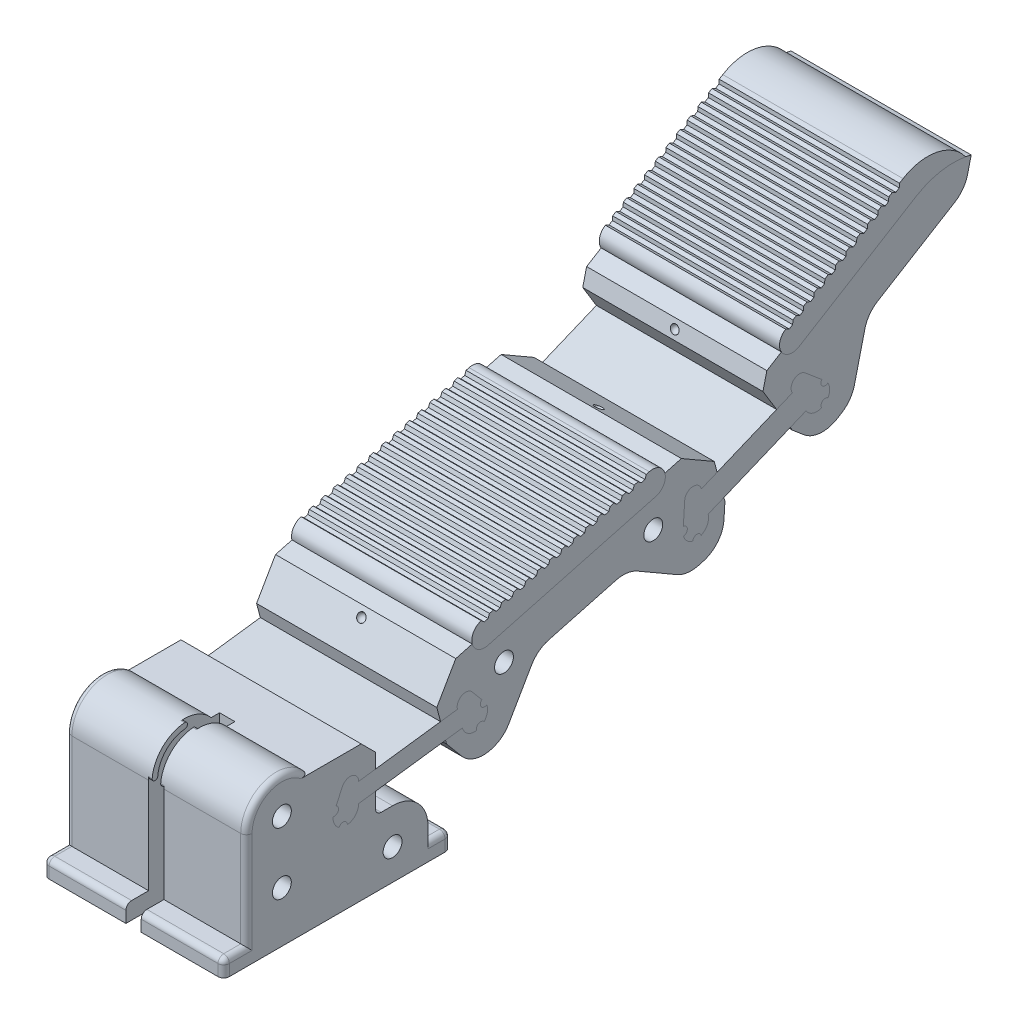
SolidWorks part; units mm, degrees
other "<finger_flexure_print>-<Pulley Cover Fillet>"
ref_plane "Front Plane" through (0, 0, 0) normal (0, 0, 1) x (1, 0, 0)
ref_plane "Top Plane" through (0, 0, 0) normal (0, 1, 0) x (1, 0, 0)
ref_plane "Right Plane" through (0, 0, 0) normal (1, 0, 0) x (0, 0, -1)
inserted part "finger_flexure_print"
sketch "Sketch1" plane through (15.875, 0, 0) normal (1, 0, 0) x (0, 0, -1)
  line L4 (69.9743, 11.2938) -> (87.2122, 18.4339)
  line L5 (65.8378, 15.4405) -> (65.6013, 11.5982)
  line L6 (84.8057, 22.3731) -> (68.7839, 15.7366)
  line L7 (90.0086, 21.8108) -> (87.0523, 24.3021)
  line L8 (69.9743, 11.2938) -> (87.2122, 18.4339)
  line L9 (65.8378, 15.4405) -> (65.6013, 11.5982)
  line L10 (84.8057, 22.3731) -> (68.7839, 15.7366)
  line L11 (90.0086, 21.8108) -> (87.0523, 24.3021)
  line L12 (30.1016, 2.9234) -> (28.4068, 4.9462)
  line L13 (8.4007, -2.0861) -> (26.6852, 0.3211)
  line L14 (5.5407, 1.9358) -> (4.4272, -0.4567)
  line L15 (25.8081, 3.5947) -> (8.4007, 1.3029)
  line L16 (30.1016, 2.9234) -> (28.4068, 4.9462)
  line L17 (8.4007, -2.0861) -> (26.6852, 0.3211)
  line L18 (5.5407, 1.9358) -> (4.4272, -0.4567)
  line L19 (25.8081, 3.5947) -> (8.4007, 1.3029)
  line L45 (85.9658, 28.8324) -> (106.651, 41.4695)
  line L46 (84.2607, 32.3908) -> (83.6198, 32.6725)
  line L47 (84.858, 32.7557) -> (84.2607, 32.3908)
  line L48 (84.8999, 33.4545) -> (84.858, 32.7557)
  line L49 (85.4972, 33.8194) -> (84.8999, 33.4545)
  line L50 (86.138, 33.5377) -> (85.4972, 33.8194)
  line L51 (86.7354, 33.9026) -> (86.138, 33.5377)
  line L52 (86.7772, 34.6014) -> (86.7354, 33.9026)
  line L53 (87.3746, 34.9663) -> (86.7772, 34.6014)
  line L54 (88.0154, 34.6846) -> (87.3746, 34.9663)
  line L55 (88.6128, 35.0496) -> (88.0154, 34.6846)
  line L56 (88.6546, 35.7483) -> (88.6128, 35.0496)
  line L57 (31.1626, 10.6686) -> (60.7665, 18.601)
  line L58 (30.5329, 14.5639) -> (29.9979, 15.0153)
  line L59 (31.2091, 14.7451) -> (30.5329, 14.5639)
  line L60 (31.4468, 15.4035) -> (31.2091, 14.7451)
  line L61 (32.1229, 15.5847) -> (31.4468, 15.4035)
  line L62 (32.658, 15.1333) -> (32.1229, 15.5847)
  line L63 (33.3341, 15.3145) -> (32.658, 15.1333)
  line L64 (33.5718, 15.9729) -> (33.3341, 15.3145)
  line L65 (34.248, 16.1541) -> (33.5718, 15.9729)
  line L66 (34.783, 15.7027) -> (34.248, 16.1541)
  line L67 (35.4592, 15.8839) -> (34.783, 15.7027)
  line L68 (35.6968, 16.5423) -> (35.4592, 15.8839)
  line L69 (36.373, 16.7235) -> (35.6968, 16.5423)
  line L70 (36.908, 16.2721) -> (36.373, 16.7235)
  line L71 (37.5842, 16.4533) -> (36.908, 16.2721)
  line L72 (37.8219, 17.1117) -> (37.5842, 16.4533)
  line L73 (38.498, 17.2929) -> (37.8219, 17.1117)
  line L74 (39.0331, 16.8415) -> (38.498, 17.2929)
  line L75 (39.7092, 17.0227) -> (39.0331, 16.8415)
  line L76 (39.9469, 17.6811) -> (39.7092, 17.0227)
  line L77 (40.6231, 17.8623) -> (39.9469, 17.6811)
  line L78 (41.1581, 17.4109) -> (40.6231, 17.8623)
  line L79 (41.8343, 17.5921) -> (41.1581, 17.4109)
  line L80 (42.072, 18.2505) -> (41.8343, 17.5921)
  line L81 (42.7481, 18.4317) -> (42.072, 18.2505)
  line L82 (43.2832, 17.9803) -> (42.7481, 18.4317)
  line L83 (43.9593, 18.1615) -> (43.2832, 17.9803)
  line L84 (44.197, 18.8199) -> (43.9593, 18.1615)
  line L85 (44.8731, 19.0011) -> (44.197, 18.8199)
  line L86 (45.4082, 18.5497) -> (44.8731, 19.0011)
  line L87 (46.0843, 18.7309) -> (45.4082, 18.5497)
  line L88 (46.322, 19.3893) -> (46.0843, 18.7309)
  line L89 (46.9982, 19.5705) -> (46.322, 19.3893)
  line L90 (47.5332, 19.1191) -> (46.9982, 19.5705)
  line L91 (48.2094, 19.3003) -> (47.5332, 19.1191)
  line L92 (48.4471, 19.9587) -> (48.2094, 19.3003)
  line L93 (49.1232, 20.1399) -> (48.4471, 19.9587)
  line L94 (49.6583, 19.6885) -> (49.1232, 20.1399)
  line L95 (50.3344, 19.8697) -> (49.6583, 19.6885)
  line L96 (50.5721, 20.5281) -> (50.3344, 19.8697)
  line L97 (51.2482, 20.7093) -> (50.5721, 20.5281)
  line L98 (51.7833, 20.2579) -> (51.2482, 20.7093)
  line L99 (52.4594, 20.4391) -> (51.7833, 20.2579)
  line L100 (52.6971, 21.0975) -> (52.4594, 20.4391)
  line L101 (53.3733, 21.2787) -> (52.6971, 21.0975)
  line L102 (53.9083, 20.8273) -> (53.3733, 21.2787)
  line L103 (54.5845, 21.0085) -> (53.9083, 20.8273)
  line L104 (54.8222, 21.6669) -> (54.5845, 21.0085)
  line L105 (55.4983, 21.8481) -> (54.8222, 21.6669)
  line L106 (56.0334, 21.3967) -> (55.4983, 21.8481)
  line L107 (56.7095, 21.5779) -> (56.0334, 21.3967)
  line L108 (56.9472, 22.2363) -> (56.7095, 21.5779)
  line L109 (57.6234, 22.4175) -> (56.9472, 22.2363)
  line L110 (58.1584, 21.9661) -> (57.6234, 22.4175)
  line L111 (58.8346, 22.1473) -> (58.1584, 21.9661)
  line L112 (59.0722, 22.8057) -> (58.8346, 22.1473)
  line L113 (59.6018, 22.9476) -> (59.0722, 22.8057)
  line L114 (31.1626, 10.6686) -> (60.7665, 18.601)
  line L115 (30.5329, 14.5639) -> (29.9979, 15.0153)
  line L116 (31.2091, 14.7451) -> (30.5329, 14.5639)
  line L117 (31.4468, 15.4035) -> (31.2091, 14.7451)
  line L118 (32.1229, 15.5847) -> (31.4468, 15.4035)
  line L119 (32.658, 15.1333) -> (32.1229, 15.5847)
  line L120 (33.3341, 15.3145) -> (32.658, 15.1333)
  line L121 (33.5718, 15.9729) -> (33.3341, 15.3145)
  line L122 (34.248, 16.1541) -> (33.5718, 15.9729)
  line L123 (34.783, 15.7027) -> (34.248, 16.1541)
  line L124 (35.4592, 15.8839) -> (34.783, 15.7027)
  line L125 (35.6968, 16.5423) -> (35.4592, 15.8839)
  line L126 (36.373, 16.7235) -> (35.6968, 16.5423)
  line L127 (36.908, 16.2721) -> (36.373, 16.7235)
  line L128 (37.5842, 16.4533) -> (36.908, 16.2721)
  line L129 (37.8219, 17.1117) -> (37.5842, 16.4533)
  line L130 (38.498, 17.2929) -> (37.8219, 17.1117)
  line L131 (39.0331, 16.8415) -> (38.498, 17.2929)
  line L132 (39.7092, 17.0227) -> (39.0331, 16.8415)
  line L133 (39.9469, 17.6811) -> (39.7092, 17.0227)
  line L134 (40.6231, 17.8623) -> (39.9469, 17.6811)
  line L135 (41.1581, 17.4109) -> (40.6231, 17.8623)
  line L136 (41.8343, 17.5921) -> (41.1581, 17.4109)
  line L137 (42.072, 18.2505) -> (41.8343, 17.5921)
  line L138 (42.7481, 18.4317) -> (42.072, 18.2505)
  line L139 (43.2832, 17.9803) -> (42.7481, 18.4317)
  line L140 (43.9593, 18.1615) -> (43.2832, 17.9803)
  line L141 (44.197, 18.8199) -> (43.9593, 18.1615)
  line L142 (44.8731, 19.0011) -> (44.197, 18.8199)
  line L143 (45.4082, 18.5497) -> (44.8731, 19.0011)
  line L144 (46.0843, 18.7309) -> (45.4082, 18.5497)
  line L145 (46.322, 19.3893) -> (46.0843, 18.7309)
  line L146 (46.9982, 19.5705) -> (46.322, 19.3893)
  line L147 (47.5332, 19.1191) -> (46.9982, 19.5705)
  line L148 (48.2094, 19.3003) -> (47.5332, 19.1191)
  line L149 (48.4471, 19.9587) -> (48.2094, 19.3003)
  line L150 (49.1232, 20.1399) -> (48.4471, 19.9587)
  line L151 (49.6583, 19.6885) -> (49.1232, 20.1399)
  line L152 (50.3344, 19.8697) -> (49.6583, 19.6885)
  line L153 (50.5721, 20.5281) -> (50.3344, 19.8697)
  line L154 (51.2482, 20.7093) -> (50.5721, 20.5281)
  line L155 (51.7833, 20.2579) -> (51.2482, 20.7093)
  line L156 (52.4594, 20.4391) -> (51.7833, 20.2579)
  line L157 (52.6971, 21.0975) -> (52.4594, 20.4391)
  line L158 (53.3733, 21.2787) -> (52.6971, 21.0975)
  line L159 (53.9083, 20.8273) -> (53.3733, 21.2787)
  line L160 (54.5845, 21.0085) -> (53.9083, 20.8273)
  line L161 (54.8222, 21.6669) -> (54.5845, 21.0085)
  line L162 (55.4983, 21.8481) -> (54.8222, 21.6669)
  line L163 (56.0334, 21.3967) -> (55.4983, 21.8481)
  line L164 (56.7095, 21.5779) -> (56.0334, 21.3967)
  line L165 (56.9472, 22.2363) -> (56.7095, 21.5779)
  line L166 (57.6234, 22.4175) -> (56.9472, 22.2363)
  line L167 (58.1584, 21.9661) -> (57.6234, 22.4175)
  line L168 (58.8346, 22.1473) -> (58.1584, 21.9661)
  line L169 (59.0722, 22.8057) -> (58.8346, 22.1473)
  line L170 (59.6018, 22.9476) -> (59.0722, 22.8057)
  line L171 (89.252, 36.1133) -> (88.6546, 35.7483)
  line L172 (89.8928, 35.8316) -> (89.252, 36.1133)
  line L173 (90.4901, 36.1965) -> (89.8928, 35.8316)
  line L174 (90.532, 36.8953) -> (90.4901, 36.1965)
  line L175 (91.1293, 37.2602) -> (90.532, 36.8953)
  line L176 (91.7702, 36.9785) -> (91.1293, 37.2602)
  line L177 (92.3675, 37.3435) -> (91.7702, 36.9785)
  line L178 (92.4094, 38.0422) -> (92.3675, 37.3435)
  line L179 (93.0067, 38.4071) -> (92.4094, 38.0422)
  line L180 (93.6475, 38.1255) -> (93.0067, 38.4071)
  line L181 (94.2449, 38.4904) -> (93.6475, 38.1255)
  line L182 (94.2867, 39.1891) -> (94.2449, 38.4904)
  line L183 (94.8841, 39.5541) -> (94.2867, 39.1891)
  line L184 (95.5249, 39.2724) -> (94.8841, 39.5541)
  line L185 (96.1222, 39.6373) -> (95.5249, 39.2724)
  line L186 (96.1641, 40.3361) -> (96.1222, 39.6373)
  line L187 (96.7615, 40.701) -> (96.1641, 40.3361)
  line L188 (97.4023, 40.4193) -> (96.7615, 40.701)
  line L189 (97.9996, 40.7843) -> (97.4023, 40.4193)
  line L190 (98.0415, 41.483) -> (97.9996, 40.7843)
  line L191 (98.6388, 41.848) -> (98.0415, 41.483)
  line L192 (99.2796, 41.5663) -> (98.6388, 41.848)
  line L193 (99.877, 41.9312) -> (99.2796, 41.5663)
  line L194 (99.9189, 42.63) -> (99.877, 41.9312)
  line L195 (100.5162, 42.9949) -> (99.9189, 42.63)
  line L196 (101.157, 42.7132) -> (100.5162, 42.9949)
  line L197 (101.7544, 43.0782) -> (101.157, 42.7132)
  line L198 (101.7962, 43.7769) -> (101.7544, 43.0782)
  line L199 (102.3936, 44.1418) -> (101.7962, 43.7769)
  line L200 (103.0344, 43.8602) -> (102.3936, 44.1418)
  line L201 (103.6317, 44.2251) -> (103.0344, 43.8602)
  line L202 (103.6736, 44.9238) -> (103.6317, 44.2251)
  line L203 (104.305, 45.3096) -> (103.6736, 44.9238)
  line L204 (85.9658, 28.8324) -> (106.651, 41.4695)
  line L205 (84.2607, 32.3908) -> (83.6198, 32.6725)
  line L206 (84.858, 32.7557) -> (84.2607, 32.3908)
  line L207 (84.8999, 33.4545) -> (84.858, 32.7557)
  line L208 (85.4972, 33.8194) -> (84.8999, 33.4545)
  line L209 (86.138, 33.5377) -> (85.4972, 33.8194)
  line L210 (86.7354, 33.9026) -> (86.138, 33.5377)
  line L211 (86.7772, 34.6014) -> (86.7354, 33.9026)
  line L212 (87.3746, 34.9663) -> (86.7772, 34.6014)
  line L213 (88.0154, 34.6846) -> (87.3746, 34.9663)
  line L214 (88.6128, 35.0496) -> (88.0154, 34.6846)
  line L215 (88.6546, 35.7483) -> (88.6128, 35.0496)
  line L216 (89.252, 36.1133) -> (88.6546, 35.7483)
  line L217 (89.8928, 35.8316) -> (89.252, 36.1133)
  line L218 (90.4901, 36.1965) -> (89.8928, 35.8316)
  line L219 (90.532, 36.8953) -> (90.4901, 36.1965)
  line L220 (91.1293, 37.2602) -> (90.532, 36.8953)
  line L221 (91.7702, 36.9785) -> (91.1293, 37.2602)
  line L222 (92.3675, 37.3435) -> (91.7702, 36.9785)
  line L223 (92.4094, 38.0422) -> (92.3675, 37.3435)
  line L224 (93.0067, 38.4071) -> (92.4094, 38.0422)
  line L225 (93.6475, 38.1255) -> (93.0067, 38.4071)
  line L226 (94.2449, 38.4904) -> (93.6475, 38.1255)
  line L227 (94.2867, 39.1891) -> (94.2449, 38.4904)
  line L228 (94.8841, 39.5541) -> (94.2867, 39.1891)
  line L229 (95.5249, 39.2724) -> (94.8841, 39.5541)
  line L230 (96.1222, 39.6373) -> (95.5249, 39.2724)
  line L231 (96.1641, 40.3361) -> (96.1222, 39.6373)
  line L232 (96.7615, 40.701) -> (96.1641, 40.3361)
  line L233 (97.4023, 40.4193) -> (96.7615, 40.701)
  line L234 (97.9996, 40.7843) -> (97.4023, 40.4193)
  line L235 (98.0415, 41.483) -> (97.9996, 40.7843)
  line L236 (98.6388, 41.848) -> (98.0415, 41.483)
  line L237 (99.2796, 41.5663) -> (98.6388, 41.848)
  line L238 (99.877, 41.9312) -> (99.2796, 41.5663)
  line L239 (99.9189, 42.63) -> (99.877, 41.9312)
  line L240 (100.5162, 42.9949) -> (99.9189, 42.63)
  line L241 (101.157, 42.7132) -> (100.5162, 42.9949)
  line L242 (101.7544, 43.0782) -> (101.157, 42.7132)
  line L243 (101.7962, 43.7769) -> (101.7544, 43.0782)
  line L244 (102.3936, 44.1418) -> (101.7962, 43.7769)
  line L245 (103.0344, 43.8602) -> (102.3936, 44.1418)
  line L246 (103.6317, 44.2251) -> (103.0344, 43.8602)
  line L247 (103.6736, 44.9238) -> (103.6317, 44.2251)
  line L248 (104.305, 45.3096) -> (103.6736, 44.9238)
  arc A3 (60.7665, 18.601) -> (59.6018, 22.9476) centre (60.1841, 20.7743) ccw
  arc A4 (29.9979, 15.0153) -> (31.1626, 10.6686) centre (30.5802, 12.8419) ccw
  arc A5 (60.7665, 18.601) -> (59.6018, 22.9476) centre (60.1841, 20.7743) ccw
  arc A6 (29.9979, 15.0153) -> (31.1626, 10.6686) centre (30.5802, 12.8419) ccw
  arc A8 (115.3247, 43.1358) -> (106.651, 41.4695) centre (113.2105, 30.7324) ccw
  arc A9 (83.6198, 32.6725) -> (85.9658, 28.8324) centre (84.7928, 30.7524) ccw
  arc A10 (115.3247, 43.1358) -> (104.305, 45.3096) centre (108.632, 38.2267) ccw
  arc A11 (115.3247, 43.1358) -> (106.651, 41.4695) centre (113.2105, 30.7324) ccw
  arc A12 (83.6198, 32.6725) -> (85.9658, 28.8324) centre (84.7928, 30.7524) ccw
  arc A13 (115.3247, 43.1358) -> (104.305, 45.3096) centre (108.632, 38.2267) ccw
  arc A22 (90.0086, 21.8108) -> (91.0671, 20.7553) centre (90.5822, 21.3275) ccw
  arc A23 (91.0776, 18.4765) -> (91.0671, 20.7553) centre (89.1323, 19.6069) ccw
  arc A24 (91.0776, 18.4765) -> (89.9555, 17.513) centre (90.598, 17.8999) ccw
  arc A25 (87.2122, 18.4339) -> (89.9555, 17.513) centre (89.1323, 19.6069) ccw
  arc A26 (68.7493, 8.671) -> (69.9743, 11.2938) centre (67.801, 10.7114) ccw
  arc A27 (68.7493, 8.671) -> (67.2777, 8.5231) centre (68.026, 8.4727) ccw
  arc A28 (65.6346, 10.1039) -> (67.2777, 8.5231) centre (67.801, 10.7114) ccw
  arc A29 (65.6346, 10.1039) -> (65.6013, 11.5982) centre (65.5553, 10.8497) ccw
  arc A30 (68.7839, 15.7366) -> (65.8378, 15.4405) centre (67.335, 15.3484) ccw
  arc A31 (87.0523, 24.3021) -> (84.8057, 22.3731) centre (86.0857, 23.1551) ccw
  arc A32 (90.0086, 21.8108) -> (91.0671, 20.7553) centre (90.5822, 21.3275) ccw
  arc A33 (91.0776, 18.4765) -> (91.0671, 20.7553) centre (89.1323, 19.6069) ccw
  arc A34 (91.0776, 18.4765) -> (89.9555, 17.513) centre (90.598, 17.8999) ccw
  arc A35 (87.2122, 18.4339) -> (89.9555, 17.513) centre (89.1323, 19.6069) ccw
  arc A36 (68.7493, 8.671) -> (69.9743, 11.2938) centre (67.801, 10.7114) ccw
  arc A37 (68.7493, 8.671) -> (67.2777, 8.5231) centre (68.026, 8.4727) ccw
  arc A38 (65.6346, 10.1039) -> (67.2777, 8.5231) centre (67.801, 10.7114) ccw
  arc A39 (65.6346, 10.1039) -> (65.6013, 11.5982) centre (65.5553, 10.8497) ccw
  arc A40 (68.7839, 15.7366) -> (65.8378, 15.4405) centre (67.335, 15.3484) ccw
  arc A41 (87.0523, 24.3021) -> (84.8057, 22.3731) centre (86.0857, 23.1551) ccw
  arc A43 (30.1016, 2.9234) -> (30.9624, 1.7013) centre (30.5832, 2.3485) ccw
  arc A44 (30.4952, -0.6406) -> (30.9624, 1.7013) centre (28.8586, 0.9035) ccw
  arc A45 (30.4952, -0.6406) -> (29.183, -1.323) centre (29.8968, -1.0927) ccw
  arc A46 (26.6852, 0.3211) -> (29.183, -1.323) centre (28.8586, 0.9035) ccw
  arc A47 (6.4135, -4.3207) -> (8.4007, -2.0861) centre (6.1507, -2.0861) ccw
  arc A48 (6.4135, -4.3207) -> (4.9695, -4.0011) centre (5.6645, -4.2829) ccw
  arc A49 (3.9121, -1.8599) -> (4.9695, -4.0011) centre (6.1507, -2.0861) ccw
  arc A50 (3.9121, -1.8599) -> (4.4272, -0.4567) centre (4.1108, -1.1367) ccw
  arc A51 (8.4007, 1.3029) -> (5.5407, 1.9358) centre (6.9007, 1.3029) ccw
  arc A52 (28.4068, 4.9462) -> (25.8081, 3.5947) centre (27.257, 3.9829) ccw
  arc A53 (30.1016, 2.9234) -> (30.9624, 1.7013) centre (30.5832, 2.3485) ccw
  arc A54 (30.4952, -0.6406) -> (30.9624, 1.7013) centre (28.8586, 0.9035) ccw
  arc A55 (30.4952, -0.6406) -> (29.183, -1.323) centre (29.8968, -1.0927) ccw
  arc A56 (26.6852, 0.3211) -> (29.183, -1.323) centre (28.8586, 0.9035) ccw
  arc A57 (6.4135, -4.3207) -> (8.4007, -2.0861) centre (6.1507, -2.0861) ccw
  arc A58 (6.4135, -4.3207) -> (4.9695, -4.0011) centre (5.6645, -4.2829) ccw
  arc A59 (3.9121, -1.8599) -> (4.9695, -4.0011) centre (6.1507, -2.0861) ccw
  arc A60 (3.9121, -1.8599) -> (4.4272, -0.4567) centre (4.1108, -1.1367) ccw
  arc A61 (8.4007, 1.3029) -> (5.5407, 1.9358) centre (6.9007, 1.3029) ccw
  arc A62 (28.4068, 4.9462) -> (25.8081, 3.5947) centre (27.257, 3.9829) ccw
  dimension "D1" = 0
  dimension "D2" = 0
  dimension "D3" = 0
  dimension "D4" = 0
extrude "Pad Material" add sketch "Sketch1" against normal up to surface (31.75 mm away) separate body
sketch "Sketch2" plane through (15.875, 0, 0) normal (1, 0, 0) x (0, 0, -1)
  line L0 (11.375, 2.4005) -> (11.375, 1.6945)
  line L1 (25.8081, 3.5947) -> (8.4007, 1.3029) construction
  line L2 (22.651, 3.8851) -> (11.375, 2.4005) construction
  line L3 (8.4007, -2.0861) -> (26.6852, 0.3211) construction
  line L4 (11.375, -2.4005) -> (23.8936, -0.7524) construction
  line L5 (22.8338, 3.2031) -> (11.375, 1.6945)
  line L6 (22.651, 3.8851) -> (11.375, 2.4005)
  line L7 (11.375, -1.6945) -> (23.7109, -0.0704)
  line L8 (11.375, -2.4005) -> (23.8936, -0.7524)
  line L9 (22.651, 3.8851) -> (22.8338, 3.2031)
  line L10 (71.3728, 17.5667) -> (71.5555, 16.8847)
  line L11 (81.6646, 21.8297) -> (82.034, 21.225)
  line L12 (81.6646, 21.8297) -> (71.3728, 17.5667) construction
  line L13 (84.8057, 22.3731) -> (68.7839, 15.7366) construction
  line L14 (69.9743, 11.2938) -> (87.2122, 18.4339) construction
  line L15 (72.9287, 11.7598) -> (84.81, 16.6812) construction
  line L16 (81.6646, 21.8297) -> (71.3728, 17.5667)
  line L17 (82.034, 21.225) -> (71.5555, 16.8847)
  line L18 (72.746, 12.4418) -> (84.4406, 17.2859)
  line L19 (72.9287, 11.7598) -> (84.81, 16.6812)
  line L20 (72.746, 12.4418) -> (72.9287, 11.7598)
  line L21 (84.4406, 17.2859) -> (84.81, 16.6812)
  line L22 (11.375, -1.6945) -> (11.375, -2.4005)
  line L23 (23.7109, -0.0704) -> (23.8936, -0.7524)
  line L24 (59.4206, 23.6238) -> (29.8167, 15.6914) construction
  line L25 (59.4206, 23.6238) -> (29.8167, 15.6914)
  line L26 (103.94, 45.9069) -> (83.2549, 33.2698) construction
  line L27 (103.94, 45.9069) -> (83.2549, 33.2698)
  line L28 (27.7307, 12.0784) -> (28.4069, 12.2596)
  line L29 (82.2755, 29.2145) -> (82.8728, 29.5794)
  line L30 (115.3247, 43.1358) -> (116.3122, 42.9188)
  line L31 (62.3575, 21.3566) -> (63.0336, 21.5378)
  line L73 (85.9658, 28.8324) -> (106.651, 41.4695)
  line L74 (84.2607, 32.3908) -> (83.6198, 32.6725)
  line L75 (84.858, 32.7557) -> (84.2607, 32.3908)
  line L76 (84.8999, 33.4545) -> (84.858, 32.7557)
  line L77 (85.4972, 33.8194) -> (84.8999, 33.4545)
  line L78 (86.138, 33.5377) -> (85.4972, 33.8194)
  line L79 (86.7354, 33.9026) -> (86.138, 33.5377)
  line L80 (86.7772, 34.6014) -> (86.7354, 33.9026)
  line L81 (87.3746, 34.9663) -> (86.7772, 34.6014)
  line L82 (88.0154, 34.6846) -> (87.3746, 34.9663)
  line L83 (88.6128, 35.0496) -> (88.0154, 34.6846)
  line L84 (88.6546, 35.7483) -> (88.6128, 35.0496)
  line L85 (31.1626, 10.6686) -> (60.7665, 18.601)
  line L86 (30.5329, 14.5639) -> (29.9979, 15.0153)
  line L87 (31.2091, 14.7451) -> (30.5329, 14.5639)
  line L88 (31.4468, 15.4035) -> (31.2091, 14.7451)
  line L89 (32.1229, 15.5847) -> (31.4468, 15.4035)
  line L90 (32.658, 15.1333) -> (32.1229, 15.5847)
  line L91 (33.3341, 15.3145) -> (32.658, 15.1333)
  line L92 (33.5718, 15.9729) -> (33.3341, 15.3145)
  line L93 (34.248, 16.1541) -> (33.5718, 15.9729)
  line L94 (34.783, 15.7027) -> (34.248, 16.1541)
  line L95 (35.4592, 15.8839) -> (34.783, 15.7027)
  line L96 (35.6968, 16.5423) -> (35.4592, 15.8839)
  line L97 (36.373, 16.7235) -> (35.6968, 16.5423)
  line L98 (36.908, 16.2721) -> (36.373, 16.7235)
  line L99 (37.5842, 16.4533) -> (36.908, 16.2721)
  line L100 (37.8219, 17.1117) -> (37.5842, 16.4533)
  line L101 (38.498, 17.2929) -> (37.8219, 17.1117)
  line L102 (39.0331, 16.8415) -> (38.498, 17.2929)
  line L103 (39.7092, 17.0227) -> (39.0331, 16.8415)
  line L104 (39.9469, 17.6811) -> (39.7092, 17.0227)
  line L105 (40.6231, 17.8623) -> (39.9469, 17.6811)
  line L106 (41.1581, 17.4109) -> (40.6231, 17.8623)
  line L107 (41.8343, 17.5921) -> (41.1581, 17.4109)
  line L108 (42.072, 18.2505) -> (41.8343, 17.5921)
  line L109 (42.7481, 18.4317) -> (42.072, 18.2505)
  line L110 (43.2832, 17.9803) -> (42.7481, 18.4317)
  line L111 (43.9593, 18.1615) -> (43.2832, 17.9803)
  line L112 (44.197, 18.8199) -> (43.9593, 18.1615)
  line L113 (44.8731, 19.0011) -> (44.197, 18.8199)
  line L114 (45.4082, 18.5497) -> (44.8731, 19.0011)
  line L115 (46.0843, 18.7309) -> (45.4082, 18.5497)
  line L116 (46.322, 19.3893) -> (46.0843, 18.7309)
  line L117 (46.9982, 19.5705) -> (46.322, 19.3893)
  line L118 (47.5332, 19.1191) -> (46.9982, 19.5705)
  line L119 (48.2094, 19.3003) -> (47.5332, 19.1191)
  line L120 (48.4471, 19.9587) -> (48.2094, 19.3003)
  line L121 (49.1232, 20.1399) -> (48.4471, 19.9587)
  line L122 (49.6583, 19.6885) -> (49.1232, 20.1399)
  line L123 (50.3344, 19.8697) -> (49.6583, 19.6885)
  line L124 (50.5721, 20.5281) -> (50.3344, 19.8697)
  line L125 (51.2482, 20.7093) -> (50.5721, 20.5281)
  line L126 (51.7833, 20.2579) -> (51.2482, 20.7093)
  line L127 (52.4594, 20.4391) -> (51.7833, 20.2579)
  line L128 (52.6971, 21.0975) -> (52.4594, 20.4391)
  line L129 (53.3733, 21.2787) -> (52.6971, 21.0975)
  line L130 (53.9083, 20.8273) -> (53.3733, 21.2787)
  line L131 (54.5845, 21.0085) -> (53.9083, 20.8273)
  line L132 (54.8222, 21.6669) -> (54.5845, 21.0085)
  line L133 (55.4983, 21.8481) -> (54.8222, 21.6669)
  line L134 (56.0334, 21.3967) -> (55.4983, 21.8481)
  line L135 (56.7095, 21.5779) -> (56.0334, 21.3967)
  line L136 (56.9472, 22.2363) -> (56.7095, 21.5779)
  line L137 (57.6234, 22.4175) -> (56.9472, 22.2363)
  line L138 (58.1584, 21.9661) -> (57.6234, 22.4175)
  line L139 (58.8346, 22.1473) -> (58.1584, 21.9661)
  line L140 (59.0722, 22.8057) -> (58.8346, 22.1473)
  line L141 (59.6018, 22.9476) -> (59.0722, 22.8057)
  line L143 (30.5329, 14.5639) -> (29.9979, 15.0153)
  line L144 (31.2091, 14.7451) -> (30.5329, 14.5639)
  line L145 (31.4468, 15.4035) -> (31.2091, 14.7451)
  line L146 (32.1229, 15.5847) -> (31.4468, 15.4035)
  line L147 (32.658, 15.1333) -> (32.1229, 15.5847)
  line L148 (33.3341, 15.3145) -> (32.658, 15.1333)
  line L149 (33.5718, 15.9729) -> (33.3341, 15.3145)
  line L150 (34.248, 16.1541) -> (33.5718, 15.9729)
  line L151 (34.783, 15.7027) -> (34.248, 16.1541)
  line L152 (35.4592, 15.8839) -> (34.783, 15.7027)
  line L153 (35.6968, 16.5423) -> (35.4592, 15.8839)
  line L154 (36.373, 16.7235) -> (35.6968, 16.5423)
  line L155 (36.908, 16.2721) -> (36.373, 16.7235)
  line L156 (37.5842, 16.4533) -> (36.908, 16.2721)
  line L157 (37.8219, 17.1117) -> (37.5842, 16.4533)
  line L158 (38.498, 17.2929) -> (37.8219, 17.1117)
  line L159 (39.0331, 16.8415) -> (38.498, 17.2929)
  line L160 (39.7092, 17.0227) -> (39.0331, 16.8415)
  line L161 (39.9469, 17.6811) -> (39.7092, 17.0227)
  line L162 (40.6231, 17.8623) -> (39.9469, 17.6811)
  line L163 (41.1581, 17.4109) -> (40.6231, 17.8623)
  line L164 (41.8343, 17.5921) -> (41.1581, 17.4109)
  line L165 (42.072, 18.2505) -> (41.8343, 17.5921)
  line L166 (42.7481, 18.4317) -> (42.072, 18.2505)
  line L167 (43.2832, 17.9803) -> (42.7481, 18.4317)
  line L168 (43.9593, 18.1615) -> (43.2832, 17.9803)
  line L169 (44.197, 18.8199) -> (43.9593, 18.1615)
  line L170 (44.8731, 19.0011) -> (44.197, 18.8199)
  line L171 (45.4082, 18.5497) -> (44.8731, 19.0011)
  line L172 (46.0843, 18.7309) -> (45.4082, 18.5497)
  line L173 (46.322, 19.3893) -> (46.0843, 18.7309)
  line L174 (46.9982, 19.5705) -> (46.322, 19.3893)
  line L175 (47.5332, 19.1191) -> (46.9982, 19.5705)
  line L176 (48.2094, 19.3003) -> (47.5332, 19.1191)
  line L177 (48.4471, 19.9587) -> (48.2094, 19.3003)
  line L178 (49.1232, 20.1399) -> (48.4471, 19.9587)
  line L179 (49.6583, 19.6885) -> (49.1232, 20.1399)
  line L180 (50.3344, 19.8697) -> (49.6583, 19.6885)
  line L181 (50.5721, 20.5281) -> (50.3344, 19.8697)
  line L182 (51.2482, 20.7093) -> (50.5721, 20.5281)
  line L183 (51.7833, 20.2579) -> (51.2482, 20.7093)
  line L184 (52.4594, 20.4391) -> (51.7833, 20.2579)
  line L185 (52.6971, 21.0975) -> (52.4594, 20.4391)
  line L186 (53.3733, 21.2787) -> (52.6971, 21.0975)
  line L187 (53.9083, 20.8273) -> (53.3733, 21.2787)
  line L188 (54.5845, 21.0085) -> (53.9083, 20.8273)
  line L189 (54.8222, 21.6669) -> (54.5845, 21.0085)
  line L190 (55.4983, 21.8481) -> (54.8222, 21.6669)
  line L191 (56.0334, 21.3967) -> (55.4983, 21.8481)
  line L192 (56.7095, 21.5779) -> (56.0334, 21.3967)
  line L193 (56.9472, 22.2363) -> (56.7095, 21.5779)
  line L194 (57.6234, 22.4175) -> (56.9472, 22.2363)
  line L195 (58.1584, 21.9661) -> (57.6234, 22.4175)
  line L196 (58.8346, 22.1473) -> (58.1584, 21.9661)
  line L197 (59.0722, 22.8057) -> (58.8346, 22.1473)
  line L198 (59.6018, 22.9476) -> (59.0722, 22.8057)
  line L199 (89.252, 36.1133) -> (88.6546, 35.7483)
  line L200 (89.8928, 35.8316) -> (89.252, 36.1133)
  line L201 (90.4901, 36.1965) -> (89.8928, 35.8316)
  line L202 (90.532, 36.8953) -> (90.4901, 36.1965)
  line L203 (91.1293, 37.2602) -> (90.532, 36.8953)
  line L204 (91.7702, 36.9785) -> (91.1293, 37.2602)
  line L205 (92.3675, 37.3435) -> (91.7702, 36.9785)
  line L206 (92.4094, 38.0422) -> (92.3675, 37.3435)
  line L207 (93.0067, 38.4071) -> (92.4094, 38.0422)
  line L208 (93.6475, 38.1255) -> (93.0067, 38.4071)
  line L209 (94.2449, 38.4904) -> (93.6475, 38.1255)
  line L210 (94.2867, 39.1891) -> (94.2449, 38.4904)
  line L211 (94.8841, 39.5541) -> (94.2867, 39.1891)
  line L212 (95.5249, 39.2724) -> (94.8841, 39.5541)
  line L213 (96.1222, 39.6373) -> (95.5249, 39.2724)
  line L214 (96.1641, 40.3361) -> (96.1222, 39.6373)
  line L215 (96.7615, 40.701) -> (96.1641, 40.3361)
  line L216 (97.4023, 40.4193) -> (96.7615, 40.701)
  line L217 (97.9996, 40.7843) -> (97.4023, 40.4193)
  line L218 (98.0415, 41.483) -> (97.9996, 40.7843)
  line L219 (98.6388, 41.848) -> (98.0415, 41.483)
  line L220 (99.2796, 41.5663) -> (98.6388, 41.848)
  line L221 (99.877, 41.9312) -> (99.2796, 41.5663)
  line L222 (99.9189, 42.63) -> (99.877, 41.9312)
  line L223 (100.5162, 42.9949) -> (99.9189, 42.63)
  line L224 (101.157, 42.7132) -> (100.5162, 42.9949)
  line L225 (101.7544, 43.0782) -> (101.157, 42.7132)
  line L226 (101.7962, 43.7769) -> (101.7544, 43.0782)
  line L227 (102.3936, 44.1418) -> (101.7962, 43.7769)
  line L228 (103.0344, 43.8602) -> (102.3936, 44.1418)
  line L229 (103.6317, 44.2251) -> (103.0344, 43.8602)
  line L230 (103.6736, 44.9238) -> (103.6317, 44.2251)
  line L231 (104.305, 45.3096) -> (103.6736, 44.9238)
  line L233 (84.2607, 32.3908) -> (83.6198, 32.6725)
  line L234 (84.858, 32.7557) -> (84.2607, 32.3908)
  line L235 (84.8999, 33.4545) -> (84.858, 32.7557)
  line L236 (85.4972, 33.8194) -> (84.8999, 33.4545)
  line L237 (86.138, 33.5377) -> (85.4972, 33.8194)
  line L238 (86.7354, 33.9026) -> (86.138, 33.5377)
  line L239 (86.7772, 34.6014) -> (86.7354, 33.9026)
  line L240 (87.3746, 34.9663) -> (86.7772, 34.6014)
  line L241 (88.0154, 34.6846) -> (87.3746, 34.9663)
  line L242 (88.6128, 35.0496) -> (88.0154, 34.6846)
  line L243 (88.6546, 35.7483) -> (88.6128, 35.0496)
  line L244 (89.252, 36.1133) -> (88.6546, 35.7483)
  line L245 (89.8928, 35.8316) -> (89.252, 36.1133)
  line L246 (90.4901, 36.1965) -> (89.8928, 35.8316)
  line L247 (90.532, 36.8953) -> (90.4901, 36.1965)
  line L248 (91.1293, 37.2602) -> (90.532, 36.8953)
  line L249 (91.7702, 36.9785) -> (91.1293, 37.2602)
  line L250 (92.3675, 37.3435) -> (91.7702, 36.9785)
  line L251 (92.4094, 38.0422) -> (92.3675, 37.3435)
  line L252 (93.0067, 38.4071) -> (92.4094, 38.0422)
  line L253 (93.6475, 38.1255) -> (93.0067, 38.4071)
  line L254 (94.2449, 38.4904) -> (93.6475, 38.1255)
  line L255 (94.2867, 39.1891) -> (94.2449, 38.4904)
  line L256 (94.8841, 39.5541) -> (94.2867, 39.1891)
  line L257 (95.5249, 39.2724) -> (94.8841, 39.5541)
  line L258 (96.1222, 39.6373) -> (95.5249, 39.2724)
  line L259 (96.1641, 40.3361) -> (96.1222, 39.6373)
  line L260 (96.7615, 40.701) -> (96.1641, 40.3361)
  line L261 (97.4023, 40.4193) -> (96.7615, 40.701)
  line L262 (97.9996, 40.7843) -> (97.4023, 40.4193)
  line L263 (98.0415, 41.483) -> (97.9996, 40.7843)
  line L264 (98.6388, 41.848) -> (98.0415, 41.483)
  line L265 (99.2796, 41.5663) -> (98.6388, 41.848)
  line L266 (99.877, 41.9312) -> (99.2796, 41.5663)
  line L267 (99.9189, 42.63) -> (99.877, 41.9312)
  line L268 (100.5162, 42.9949) -> (99.9189, 42.63)
  line L269 (101.157, 42.7132) -> (100.5162, 42.9949)
  line L270 (101.7544, 43.0782) -> (101.157, 42.7132)
  line L271 (101.7962, 43.7769) -> (101.7544, 43.0782)
  line L272 (102.3936, 44.1418) -> (101.7962, 43.7769)
  line L273 (103.0344, 43.8602) -> (102.3936, 44.1418)
  line L274 (103.6317, 44.2251) -> (103.0344, 43.8602)
  line L275 (103.6736, 44.9238) -> (103.6317, 44.2251)
  line L276 (104.305, 45.3096) -> (103.6736, 44.9238)
  arc A0 (29.8167, 15.6914) -> (27.7307, 12.0784) centre (30.5802, 12.8419) ccw construction
  arc A1 (63.0336, 21.5378) -> (59.4206, 23.6238) centre (60.1841, 20.7743) ccw construction
  arc A2 (29.8167, 15.6914) -> (27.7307, 12.0784) centre (30.5802, 12.8419) ccw
  arc A3 (63.0336, 21.5378) -> (59.4206, 23.6238) centre (60.1841, 20.7743) ccw
  arc A4 (116.3122, 42.9188) -> (103.94, 45.9069) centre (108.632, 38.2267) ccw construction
  arc A5 (83.2549, 33.2698) -> (82.2755, 29.2145) centre (84.7928, 30.7524) ccw construction
  arc A6 (116.3122, 42.9188) -> (103.94, 45.9069) centre (108.632, 38.2267) ccw
  arc A7 (83.2549, 33.2698) -> (82.2755, 29.2145) centre (84.7928, 30.7524) ccw
  arc A10 (60.7665, 18.601) -> (59.6018, 22.9476) centre (60.1841, 20.7743) ccw
  arc A11 (29.9979, 15.0153) -> (31.1626, 10.6686) centre (30.5802, 12.8419) ccw
  arc A12 (62.3575, 21.3566) -> (59.6018, 22.9476) centre (60.1841, 20.7743) ccw
  arc A13 (29.9979, 15.0153) -> (28.4069, 12.2596) centre (30.5802, 12.8419) ccw
  arc A15 (115.3247, 43.1358) -> (106.651, 41.4695) centre (113.2105, 30.7324) ccw
  arc A16 (83.6198, 32.6725) -> (85.9658, 28.8324) centre (84.7928, 30.7524) ccw
  arc A17 (115.3247, 43.1358) -> (104.305, 45.3096) centre (108.632, 38.2267) ccw
  arc A19 (83.6198, 32.6725) -> (82.8728, 29.5794) centre (84.7928, 30.7524) ccw
  arc A20 (115.3247, 43.1358) -> (104.305, 45.3096) centre (108.632, 38.2267) ccw
  dimension "D1" = 0
  dimension "D2" = 0
extrude "Wall Removal" cut sketch "Sketch2" against normal through all
